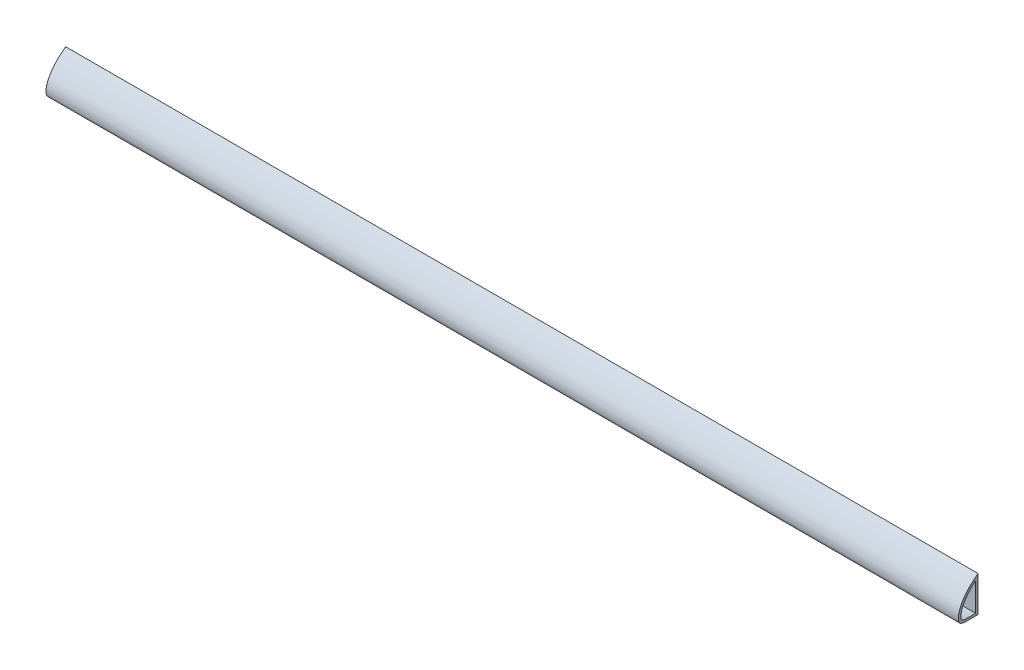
SolidWorks part; units mm, degrees
ref_plane "Front Plane" through (0, 0, 0) normal (0, 0, 1) x (1, 0, 0)
ref_plane "Top Plane" through (0, 0, 0) normal (0, 1, 0) x (1, 0, 0)
ref_plane "Right Plane" through (0, 0, 0) normal (1, 0, 0) x (0, 0, -1)
curve "Curve1"
sketch "Sketch1" plane through (0, 0, 0) normal (1, 0, 0) x (0, 0, -1)
  line L0 (5.5563, 7.678) -> (5.5563, -1.4496)
  line L1 (0, 0) -> (0, 95.7684) construction
  line L2 (6.35, 9.3114) -> (6.35, -2.2105)
  line L3 (6.35, 0) -> (0, 0) construction
  spline S0 degree 1 poles (5.5563, 7.678) (5.5563, -1.4496) knots 0 0 1 1 construction
  spline S1 degree 3 poles (6.35, 9.3114) (6.1094, 9.1325) (5.2783, 8.4962) (3.9696, 7.3829) (2.5771, 5.9111) (1.5074, 4.4336) (0.7171, 2.9962) (0.2104, 1.6314) (-0.0312, 0.3715) (0.015, -0.6941) (0.289, -1.6715) (1.3086, -2.157) (2.6797, -2.2255) (4.4184, -2.2873) (5.6979, -2.2422) (6.35, -2.2105) knots 0.473049 0.473049 0.473049 0.473049 0.475988 0.483309 0.489875 0.495803 0.501149 0.505903 0.510047 0.513579 0.516447 0.51935 0.523823 0.529974 0.536375 0.536375 0.536375 0.536375
  spline S2 degree 3 poles (5.5563, -1.4496) (5.2114, -1.4615) (4.518, -1.4776) (3.4976, -1.4602) (2.414, -1.4205) (1.6563, -1.3685) (1.2104, -1.2209) (1.0472, -1.1257) (0.995, -1.0775) (0.9667, -1.0377) (0.8933, -0.8729) (0.8198, -0.5065) (0.7861, -0.074) (0.8082, 0.5088) (0.9549, 1.2807) (1.2616, 2.2009) (1.8094, 3.3873) (2.7074, 4.8039) (4.0185, 6.3223) (5.0344, 7.2426) (5.5563, 7.678) knots 0.478463 0.478463 0.478463 0.478463 0.481925 0.485388 0.488851 0.492314 0.494045 0.494911 0.495777 0.496643 0.497508 0.49924 0.500971 0.502703 0.506166 0.509628 0.513091 0.520017 0.526943 0.533869 0.533869 0.533869 0.533869
  dimension "D1" = 0.7937
  dimension "D2" = 6.35
extrude "Boss-Extrude1" add sketch "Sketch1" along normal mid plane 295.275
